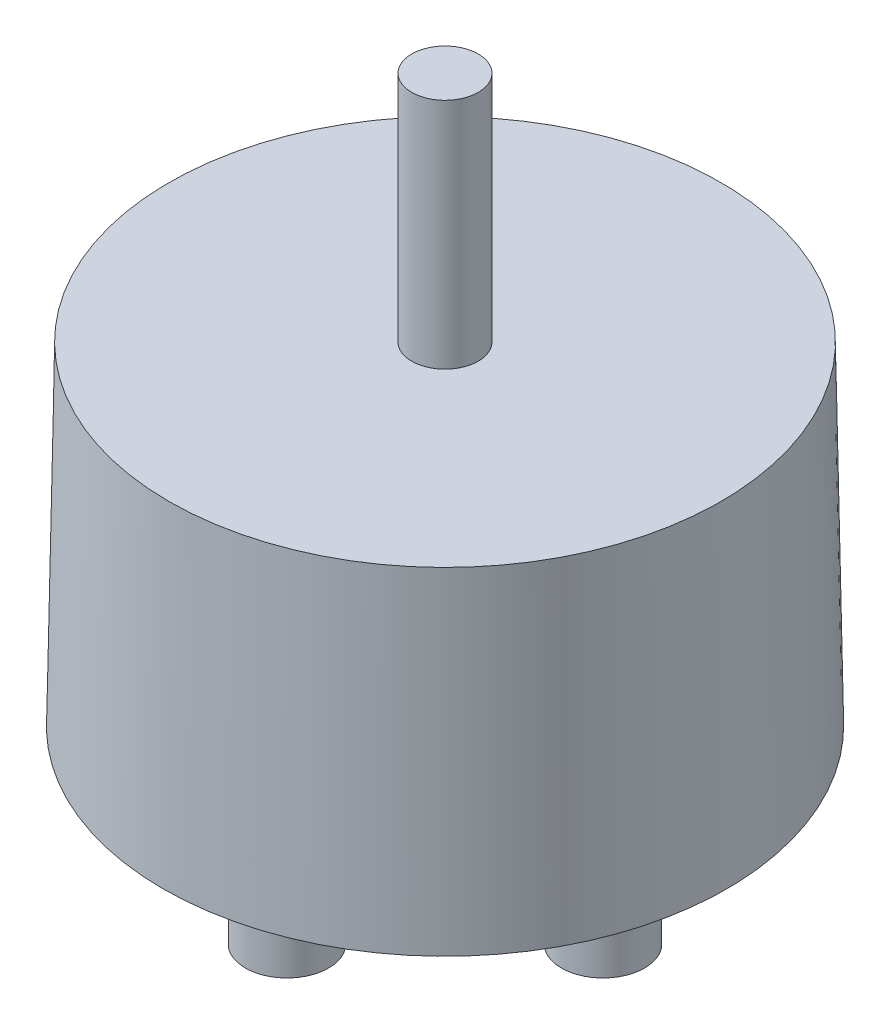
SolidWorks part; units mm, degrees
ref_plane "Front Plane" through (0, 0, 0) normal (0, 0, 1) x (1, 0, 0)
ref_plane "Top Plane" through (0, 0, 0) normal (0, 1, 0) x (1, 0, 0)
ref_plane "Right Plane" through (0, 0, 0) normal (1, 0, 0) x (0, 0, -1)
sketch "Sketch1" plane through (0, 0, 0) normal (0, 1, 0) x (1, 0, 0)
  line L0 (0, -9.5) -> (0, 9.5) construction
  line L1 (-9.5, 0) -> (9.5, 0) construction
  circle A0 centre (0, 0) radius 7 construction
  circle A1 centre (0, 0) radius 9.5 construction
  circle A2 centre (0, 9.5) radius 1.5
  circle A3 centre (9.5, 0) radius 1.5
  circle A4 centre (0, -9.5) radius 1.5
  circle A5 centre (-9.5, 0) radius 1.5
  arc A7 (-7.7895, 1.8232) -> (-7.7895, -1.8232) centre (-9.5, 0) ccw
  arc A8 (1.8232, 7.7895) -> (-1.8232, 7.7895) centre (0, 9.5) ccw
  arc A9 (7.7895, -1.8232) -> (7.7895, 1.8232) centre (9.5, 0) ccw
  arc A10 (-1.8232, -7.7895) -> (1.8232, -7.7895) centre (0, -9.5) ccw
  circle A12 centre (-9.5, 0) radius 2.5 construction
  circle A13 centre (0, -9.5) radius 2.5 construction
  circle A14 centre (9.5, 0) radius 2.5 construction
  circle A15 centre (0, 9.5) radius 2.5 construction
  arc A19 (-7.7895, -1.8232) -> (-1.8232, -7.7895) centre (-7.7895, -7.7895) cw
  arc A20 (1.8232, -7.7895) -> (7.7895, -1.8232) centre (7.7895, -7.7895) cw
  arc A21 (7.7895, 1.8232) -> (1.8232, 7.7895) centre (7.7895, 7.7895) cw
  arc A22 (-1.8232, 7.7895) -> (-7.7895, 1.8232) centre (-7.7895, 7.7895) cw
  point P16 (0, 0)
  point P17 (0, 0)
  point P27 (-7, 0)
  point P29 (2.5, -9.5)
  point P32 (12, 0)
  point P35 (2.5, 9.5)
  point P38 (8, 0)
  dimension "D1" = 14
  dimension "D2" = 19
  dimension "D3" = 3
  dimension "D5" = 1
extrude "Boss-Extrude1" add sketch "Sketch1" along normal blind 6.6
sketch "Sketch2" plane through (0, 6.6, 0) normal (0, 1, 0) x (1, 0, 0)
  circle A1 centre (0, 0) radius 16.95
  dimension "D1" = 33.9
extrude "Boss-Extrude2" add sketch "Sketch2" along normal blind 20 draft 1
sketch "Sketch3" plane through (0, 26.6, 0) normal (0, 1, 0) x (1, 0, 0)
  circle A0 centre (0, 0) radius 2
  dimension "D1" = 4
extrude "Boss-Extrude3" add sketch "Sketch3" along normal blind 14 contours A0
